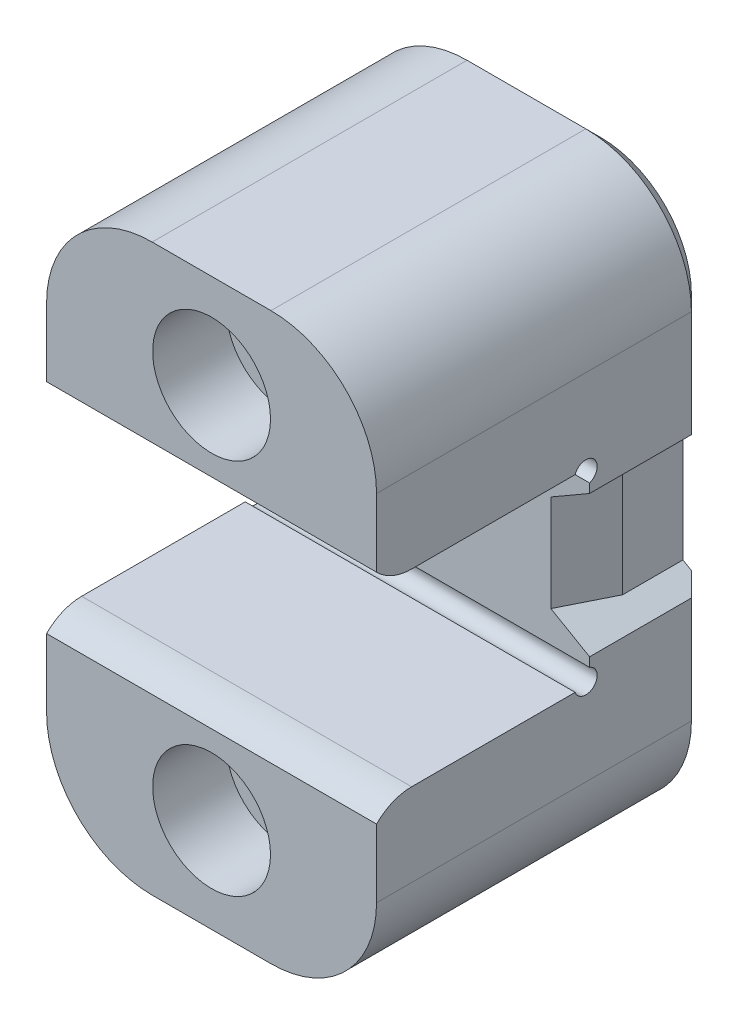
SolidWorks part; units mm, degrees
ref_plane "Front Plane" through (0, 0, 0) normal (0, 0, 1) x (1, 0, 0)
ref_plane "Top Plane" through (0, 0, 0) normal (0, 1, 0) x (1, 0, 0)
ref_plane "Right Plane" through (0, 0, 0) normal (1, 0, 0) x (0, 0, -1)
sketch "Sketch1" plane through (0, 0, 0) normal (1, 0, 0) x (0, 0, -1)
  line L0 (0, 0) -> (50000, 0) construction
  line L1 (0, 6.35) -> (14.351, 6.35)
  line L2 (0, 19.05) -> (22.225, 19.05)
  line L3 (0, 19.05) -> (0, 6.35)
  line L4 (0, -19.05) -> (22.225, -19.05)
  line L5 (22.225, 19.05) -> (22.225, -19.05)
  line L6 (14.351, 6.35) -> (14.351, -6.35)
  line L7 (14.351, -6.35) -> (0, -6.35)
  line L9 (0, 10.4775) -> (0, -10.4775) construction
  line L10 (0, -6.35) -> (0, -19.05)
  dimension "D1" = 22.225
  dimension "D2" = 38.1
  dimension "D3" = 14.351
  dimension "D4" = 12.7
extrude "Extrude1" add sketch "Sketch1" along normal mid plane 22.225
fillet "Fillet1" radius 7.112 4 edges at (-11.1125, -19.05, -11.1125) (-11.1125, 19.05, -11.1125) (11.1125, -19.05, -11.1125) (11.1125, 19.05, -11.1125)
sketch "Sketch2" plane through (-11.1125, 0, -22.225) normal (0, 0, 1) x (1, 0, 0)
  line L0 (0, 0) -> (50000, 0) construction
  line L1 (22.225, -11.938) -> (22.225, 11.938) construction
  line L2 (20.6375, 3.846) -> (23.8125, 5.679)
  line L3 (20.6375, 3.846) -> (20.6375, -3.846)
  line L4 (20.6375, -3.846) -> (23.8125, -5.679)
  line L5 (23.8125, 5.679) -> (23.8125, -5.679)
  line L6 (11.1125, 0) -> (11.1125, 50000) construction
  point P4 (22.225, 4.7625)
  point P10 (22.225, -4.7625)
  dimension "D1" = 9.525
  dimension "D2" = 1.5875
  dimension "D3" = 30
  dimension "D4" = 3.175
extrude "Cut-Extrude1" cut sketch "Sketch2" along normal through all
sketch "Sketch5" plane through (11.1125, 0, 0) normal (1, 0, 0) x (0, 0, -1)
  line L0 (0, 0) -> (50000, 0) construction
  line L1 (0, 6.35) -> (14.351, 6.35) construction
  line L2 (0, 11.938) -> (0, 6.35) construction
  line L3 (0, -6.35) -> (0, -11.938) construction
  line L4 (-3.9878, -4.171) -> (2.3622, -4.171)
  line L5 (-3.9878, -4.171) -> (-3.9878, -7.346)
  line L6 (-3.9878, -7.346) -> (0, -7.346)
  line L7 (2.3622, -4.171) -> (2.3622, -6.35)
  line L8 (14.351, -6.35) -> (0, -6.35) construction
  line L9 (2.3622, 4.171) -> (2.3622, 6.35)
  line L10 (-3.9878, 7.346) -> (0, 7.346)
  line L11 (-3.9878, 4.171) -> (-3.9878, 7.346)
  line L12 (-3.9878, 4.171) -> (2.3622, 4.171)
  arc A0 (0.5438, -6.6159) -> (2.3622, -6.35) centre (2.3622, -12.7) cw construction
  arc A1 (0, -7.346) -> (0.5438, -6.6159) centre (0.762, -7.346) cw construction
  arc A2 (0, 7.346) -> (0.5438, 6.6159) centre (0.762, 7.346) ccw construction
  arc A3 (0.5438, 6.6159) -> (2.3622, 6.35) centre (2.3622, 12.7) ccw construction
  arc A4 (0, 7.346) -> (2.3622, 6.35) centre (2.3622, 9.6492) ccw
  arc A5 (0, -7.346) -> (2.3622, -6.35) centre (2.3622, -9.6492) cw
  dimension "D1" = 0.762
  dimension "D2" = 6.35
  dimension "D3" = 3.175
  dimension "D4" = 6.35
  dimension "D5" = 2.3622
extrude "Cut-Extrude2" cut sketch "Sketch5" against normal through all
sketch "Sketch6" plane through (11.1125, 0, 0) normal (1, 0, 0) x (0, 0, -1)
  line L0 (0, 0) -> (50000, 0) construction
  line L3 (14.351, 6.35) -> (14.351, 4.7625) construction
  line L4 (2.3622, 6.35) -> (14.351, 6.35) construction
  circle A0 centre (14.097, 6.096) radius 0.762
  circle A1 centre (14.097, -6.096) radius 0.762
  dimension "D2" = 0.508
  dimension "D3" = 0.762
  dimension "D1" = 0.508
extrude "Cut-Extrude3" cut sketch "Sketch6" against normal through all
hole_wizard "CBORE for #8 Socket Head Cap Screw1" positions "Sketch4" profile "Sketch3" counterbore size "#8" standard "Ansi Inch"
sketch "Sketch4" plane through (0, 0, 0) normal (0, 0, 1) x (1, 0, 0)
  line L0 (0, 0) -> (0, 50000) construction
  line L1 (0, 0) -> (50000, 0) construction
  point P0 (0, 12.7)
  point P12 (0, -12.7)
  dimension "D1" = 25.4
sketch "Sketch3" plane through (0, 12.7, 0) normal (1, 0, 0) x (0, -1, 0)
  line L0 (0, 0) -> (0, 22.225)
  line L1 (0, 22.225) -> (1.905, 22.225)
  line L3 (1.905, 22.225) -> (1.905, 4.9606)
  line L4 (1.905, 4.9606) -> (3.9687, 4.9606)
  line L5 (3.9687, 4.9606) -> (3.9687, 0)
  line L7 (3.9687, 0) -> (0, 0)
  line L11 (0, -6.35) -> (0, 107.95) construction
  dimension "Thru Hole Dia." = 3.81
  dimension "Thru Hole Depth" = 22.225
  dimension "C'Bore Dia." = 7.9375
  dimension "C'Bore Depth" = 4.9606
hole_wizard "#10-32 Tapped Hole1" positions "Sketch8" profile "Sketch7" tap size "#10-32" standard "Ansi Inch"
sketch "Sketch8" plane through (0, 0, -4.9606) normal (0, 0, 1) x (1, 0, 0)
  point P0 (0, 12.7)
  point P1 (0, -12.7)
sketch "Sketch7" plane through (0, 12.7, -4.9606) normal (1, 0, 0) x (0, -1, 0)
  line L0 (0, 0) -> (0, 17.2644)
  line L1 (0, 17.2644) -> (2.0193, 17.2644)
  line L2 (2.0193, 17.2644) -> (2.0193, 0)
  line L5 (2.0193, 0) -> (0, 0)
  line L11 (0, -6.35) -> (0, 107.95) construction
  dimension "Thread Major Dia." = 4.0386
  dimension "Thru Tap Drill Depth" = 17.2644
chamfer "Chamfer3" distance 3.81 angle 15 1 edges at (9.525, 0, -14.351)
chamfer "Chamfer1" distance 1.016 angle 45 9 edges at (-11.1125, 0, -22.225) (-9.0294, -16.9669, -22.225) (0, -19.05, -22.225) (0, 19.05, -22.225) (-9.0294, 16.9669, -22.225) (11.1125, -8.3502, -22.225) (9.0294, -16.9669, -22.225) (11.1125, 8.3503, -22.225) (9.0294, 16.9669, -22.225)
